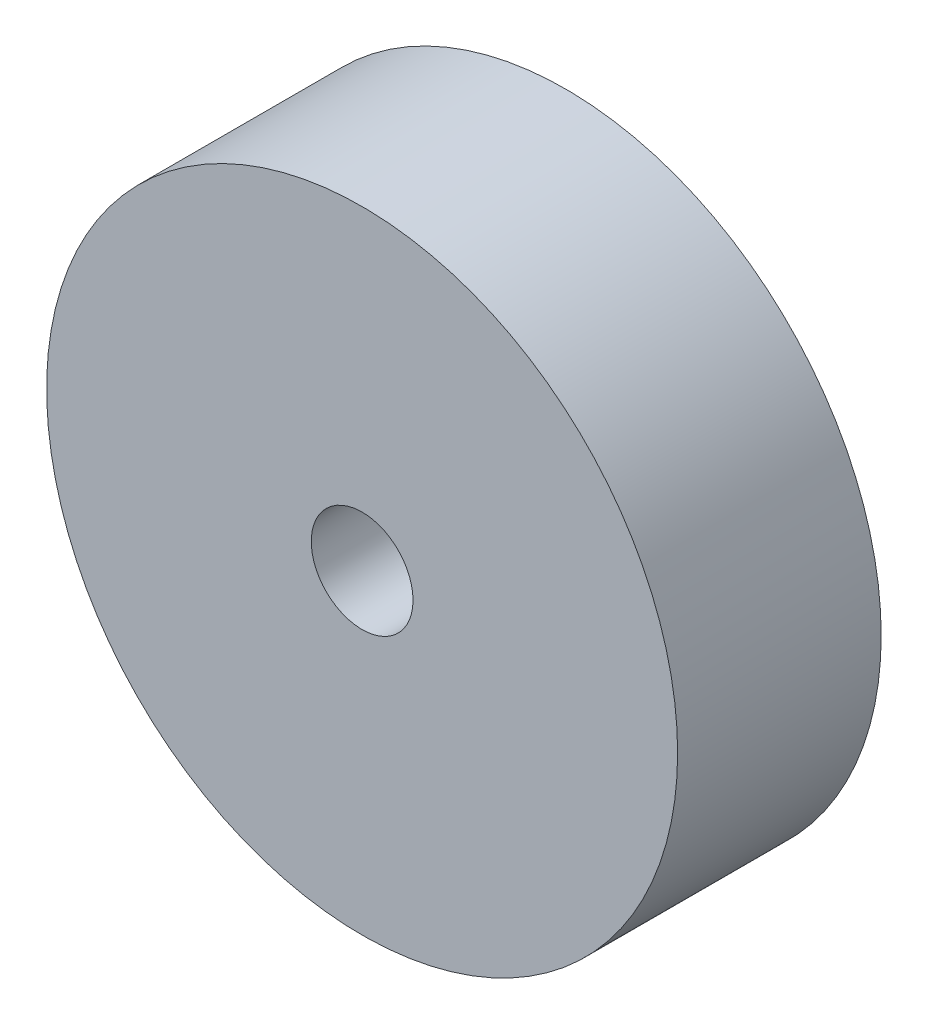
SolidWorks part; units mm, degrees
ref_plane "Front Plane" through (0, 0, 0) normal (0, 0, 1) x (1, 0, 0)
ref_plane "Top Plane" through (0, 0, 0) normal (0, 1, 0) x (1, 0, 0)
ref_plane "Right Plane" through (0, 0, 0) normal (1, 0, 0) x (0, 0, -1)
sketch "Sketch1" plane through (0, 0, 0) normal (0, 0, 1) x (1, 0, 0)
  circle A0 centre (0, 0) radius 6.2
  dimension "D1" = 12.4
extrude "Boss-Extrude1" add sketch "Sketch1" along normal mid plane 4
sketch "Sketch3" plane through (0, 0, 0) normal (0, 0, 1) x (1, 0, 0)
  circle A0 centre (0, 0) radius 1
  dimension "D1" = 2
extrude "hole for shaft" cut sketch "Sketch3" against normal through all both and the other way through all
